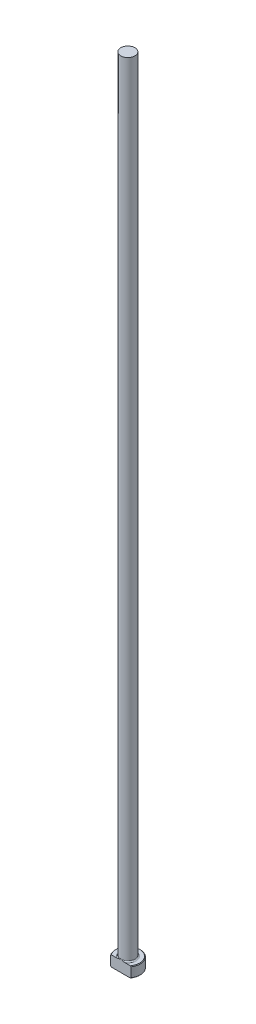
SolidWorks part; units mm, degrees
ref_plane "Front Plane" through (0, 0, 0) normal (0, 0, 1) x (1, 0, 0)
ref_plane "Top Plane" through (0, 0, 0) normal (0, 1, 0) x (1, 0, 0)
ref_plane "Right Plane" through (0, 0, 0) normal (1, 0, 0) x (0, 0, -1)
sketch "Sketch1" plane through (0, 0, 0) normal (0, 0, 1) x (1, 0, 0)
  line L0 (0, 259.9588) -> (0, -15.1925) construction
  line L1 (0, 0) -> (-5.5499, 0)
  line L2 (-5.5499, 0) -> (-5.5499, 4.7498)
  line L3 (-5.5499, 4.7498) -> (-3.175, 4.7498)
  line L4 (-3.175, 4.7498) -> (-3.175, 355.6)
  line L5 (-3.175, 355.6) -> (0, 355.6)
  line L6 (0, 355.6) -> (0, 0)
  dimension "L" = 355.6
  dimension "H" = 11.0998
  dimension "T" = 4.7498
  dimension "D" = 6.35
revolve "Revolve1" add sketch "Sketch1" angle 360 about L0
chamfer "Chamfer1" distance 0.254 angle 45 2 edges at (0, 4.7498, 5.5499) (0, 0, 5.5499)
fillet "Fillet1" radius 0.508 1 edges at (0, 4.7498, 3.175)
sketch "Sketch2" plane through (0, 0, 0) normal (0, 1, 0) x (1, 0, 0)
  line L0 (-4.552, -3.175) -> (4.552, -3.175)
  circle A0 centre (0, 0) radius 5.5499 construction
  arc A1 (-4.552, -3.175) -> (4.552, -3.175) centre (0, 0) ccw
  circle A3 centre (0, 0) radius 3.175 construction
  dimension "D1" = 0
extrude "Key" cut sketch "Sketch2" along normal through all
sketch "Pocket Sketch" plane through (0, 0, 0) normal (0, 0, 1) x (1, 0, 0)
  line L0 (-5.9468, 0) -> (-5.9468, 4.7752)
  line L1 (-5.9468, 4.7752) -> (-4.3339, 4.7752)
  line L2 (-3.5719, 5.5372) -> (-3.5719, 22.225)
  line L3 (-3.5719, 22.225) -> (0, 22.225)
  line L4 (0, 22.225) -> (0, 0)
  line L5 (0, 0) -> (-5.9468, 0)
  line L6 (0, 12.6104) -> (0, -2.4989) construction
  line L7 (-5.5499, 4.4958) -> (-5.5499, 0.254) construction
  line L8 (5.2959, 4.7498) -> (-5.2959, 4.7498) construction
  line L9 (-3.175, 355.6) -> (-3.175, 5.2578) construction
  line L10 (-4.3339, 4.7752) -> (-3.5719, 5.5372)
  point P3 (-3.5719, 4.7752)
  dimension "D1" = 11.8935
  dimension "D2" = 0.3969
  dimension "D3" = 0.0254
  dimension "D4" = 0.3969
  dimension "D5" = 7.1437
  dimension "D6" = 22.225
